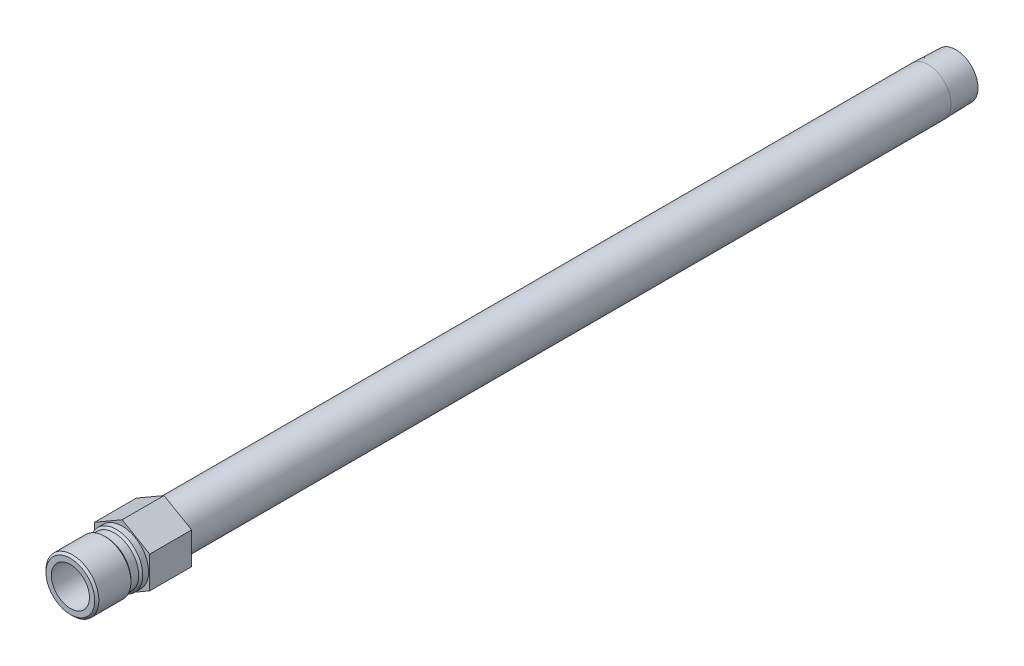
SolidWorks part; units mm, degrees
ref_plane "Front Plane" through (0, 0, 0) normal (0, 0, 1) x (1, 0, 0)
ref_plane "Top Plane" through (0, 0, 0) normal (0, 1, 0) x (1, 0, 0)
ref_plane "Right Plane" through (0, 0, 0) normal (1, 0, 0) x (0, 0, -1)
sketch "Sketch1" plane through (0, 0, 0) normal (1, 0, 0) x (0, 0, -1)
  line L0 (0, 0) -> (-22.479, 0) construction
  line L1 (-19.304, 7.112) -> (-19.304, 9.0932)
  line L2 (-5.8166, 9.0932) -> (-5.8166, 0) construction
  line L3 (-18.542, 9.8552) -> (-6.5786, 9.8552)
  line L4 (0, 8.5725) -> (0, 0) construction
  line L5 (-5.8166, 9.0932) -> (-2.921, 9.0932)
  line L6 (-2.159, 9.8552) -> (0, 9.8552)
  line L7 (0, 9.8552) -> (0, 8.5725)
  line L8 (-5.8166, 9.0932) -> (-6.5786, 9.8552)
  line L9 (-2.921, 9.0932) -> (-2.159, 9.8552)
  line L10 (-19.304, 9.0932) -> (-18.542, 9.8552)
  line L11 (-19.304, 7.112) -> (-1.524, 7.112)
  line L12 (0, 8.5725) -> (300.5582, 8.5725)
  line L13 (300.5582, 8.5725) -> (310.896, 8.2494)
  line L14 (310.896, 8.2494) -> (310.896, 6.2611)
  line L15 (0, 9.8552) -> (15.621, 9.8552) construction
  line L16 (15.621, 9.8552) -> (15.621, 0) construction
  line L17 (15.621, 0) -> (0, 0) construction
  line L18 (-1.0716, 6.2611) -> (-1.524, 7.112)
  line L19 (-1.0716, 6.2611) -> (310.896, 6.2611)
  dimension "D1" = 19.304
  dimension "D2" = 2.8956
  dimension "D3" = 0.762
  dimension "D4" = 45
  dimension "D5" = 13.4874
  dimension "D6" = 45
  dimension "D7" = 1.79
  dimension "D8" = 10.3378
  dimension "D9" = 330.2
  dimension "D10" = 3.175
  dimension "D11" = 34.925
  dimension "D12" = 14.224
  dimension "D13" = 17.145
  dimension "D14" = 19.7104
  dimension "D15" = 12.5222
  dimension "D16" = 118
  dimension "D17" = 17.78
revolve "Revolve1" add sketch "Sketch1" angle 360 about L0
sketch "Sketch2" plane through (0, 0, 0) normal (0, 0, 1) x (1, 0, 0)
  line L1 (-10.287, 5.9392) -> (-10.287, -5.9392)
  line L2 (-10.287, -5.9392) -> (0, -11.8784)
  line L3 (0, -11.8784) -> (10.287, -5.9392)
  line L4 (10.287, -5.9392) -> (10.287, 5.9392)
  line L5 (10.287, 5.9392) -> (0, 11.8784)
  line L6 (0, 11.8784) -> (-10.287, 5.9392)
  circle A0 centre (0, 0) radius 10.287 construction
  circle A1 centre (0, 0) radius 7.112 construction
  circle A2 centre (0, 0) radius 7.112
  dimension "D1" = 20.574
extrude "Boss-Extrude1" add sketch "Sketch2" against normal up to vertex (15.621 mm away) from vertex at 0
